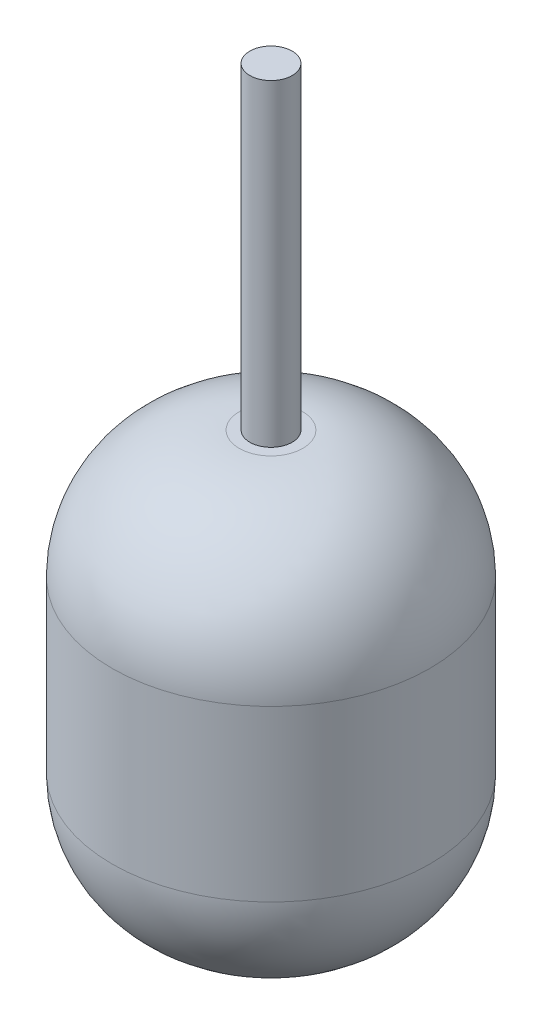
SolidWorks part; units mm, degrees
ref_plane "Front Plane" through (0, 0, 0) normal (0, 0, 1) x (1, 0, 0)
ref_plane "Top Plane" through (0, 0, 0) normal (0, 1, 0) x (1, 0, 0)
ref_plane "Right Plane" through (0, 0, 0) normal (1, 0, 0) x (0, 0, -1)
sketch "Sketch1" plane through (0, 0, 0) normal (0, 1, 0) x (1, 0, 0)
  circle A0 centre (0, 0) radius 15
  dimension "D1" = 30
extrude "Boss-Extrude1" add sketch "Sketch1" along normal blind 40
fillet "Fillet1" radius 12 2 edges at (0, 40, 15) (0, 0, 15)
sketch "Sketch2" plane through (0, 40, 0) normal (0, 1, 0) x (1, 0, 0)
  circle A0 centre (0, 0) radius 2
  dimension "D1" = 4
extrude "Boss-Extrude2" add sketch "Sketch2" along normal blind 30
